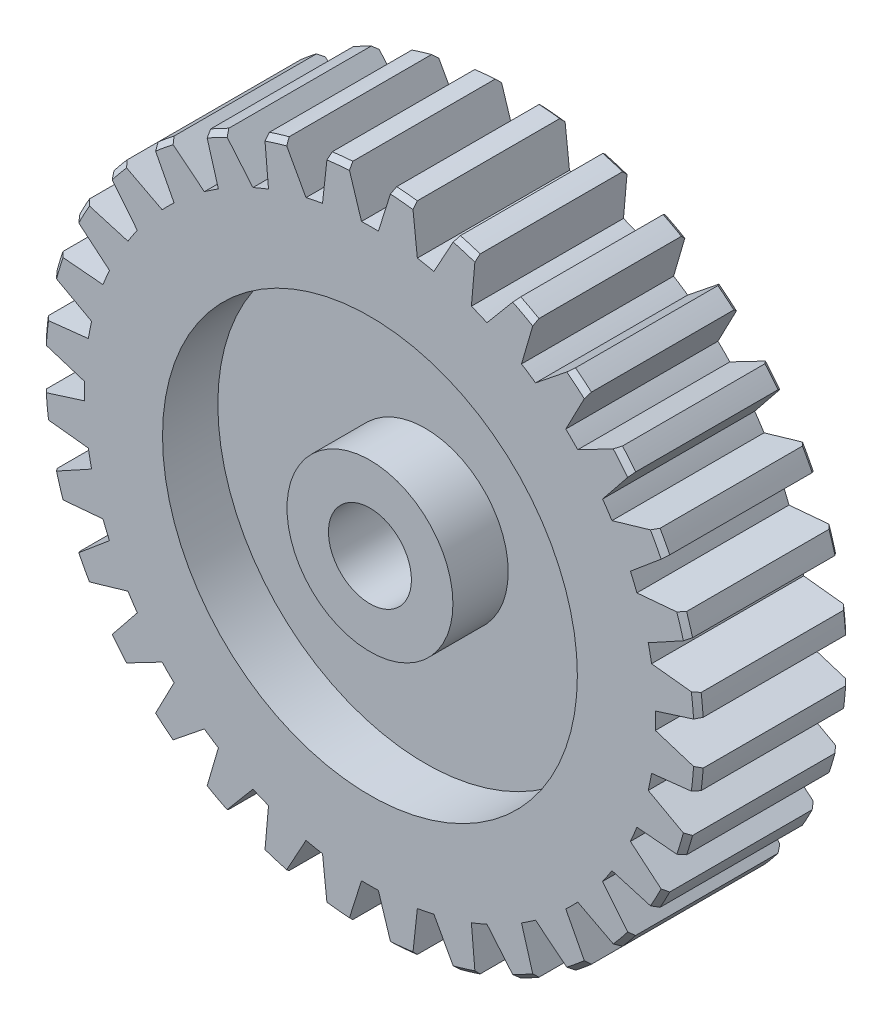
SolidWorks part; units mm, degrees
ref_plane "Plan1" through (0, 0, 0) normal (0, 0, 1) x (1, 0, 0)
ref_plane "Plan2" through (0, 0, 0) normal (0, 1, 0) x (1, 0, 0)
ref_plane "Plan3" through (0, 0, 0) normal (1, 0, 0) x (0, 0, -1)
sketch "Diamètre primitif" plane through (0, 0, 0) normal (0, 0, 1) x (1, 0, 0)
  line L0 (0, 0) -> (0.7, 0) construction
  circle A0 centre (0, 0) radius 11.2
  point P3 (0, 0)
  dimension "D1" = 22.4
  dimension "D2" = 0.7
sketch "Esquisse2" plane through (0, 0, 0) normal (0, 0, 1) x (1, 0, 0)
  circle A0 centre (0, 0) radius 11.9
  dimension "D1" = 23.8
extrude "Diamètre de tête" add sketch "Esquisse2" along normal mid plane 5.5
chamfer "Chanfreins" distance 0.175 angle 45
sketch "Esquisse3" plane through (0, 0, 0) normal (0, 0, 1) x (1, 0, 0)
  line L0 (0, 0) -> (0, 11.9) construction
  line L1 (-0.305, 10.3205) -> (-0.7946, 11.8734)
  line L2 (0.305, 10.3205) -> (0.7946, 11.8734)
  arc A0 (0.305, 10.3205) -> (-0.305, 10.3205) centre (0, 0) ccw
  circle A1 centre (0, 0) radius 11.9 construction
  arc A2 (0.7946, 11.8734) -> (-0.7946, 11.8734) centre (0, 0) ccw
  point P1 (-0.5498, 11.097)
  point P10 (0.5498, 11.097)
  dimension "D1" = 20.65
  dimension "D2" = 1.0996
  dimension "D3" = 325
extrude "Creux dent" cut sketch "Esquisse3" against normal through all and the other way through all
pattern_circular "Répétition" count 32 over 360
sketch "Esquisse4" plane through (0, 0, 2.75) normal (0, 0, 1) x (1, 0, 0)
  circle A0 centre (0, 0) radius 1.5
  dimension "D1" = 3
extrude "Passage axe" cut sketch "Esquisse4" against normal through all
sketch "Esquisse5" plane through (0, 0, 2.75) normal (0, 0, 1) x (1, 0, 0)
  circle A0 centre (0, 0) radius 3
  circle A1 centre (0, 0) radius 7.5
  dimension "D1" = 15
  dimension "D2" = 6
extrude "Gorge" cut sketch "Esquisse5" against normal blind 2
mirror "Symétrie gorge" about plane through (0, 0, 0) normal (0, 0, 1)
equation "\"D1@Esquisse2\" = \"D1@Diamètre primitif\" + 2 * \"D2@Diamètre primitif\""
equation "\"D1@Chanfreins\" = 0.25*\"D2@Diamètre primitif\""
equation "\"D1@Esquisse3\" = \"D1@Diamètre primitif\"-2.5*\"D2@Diamètre primitif\""
equation "\"D2@Esquisse3\"=3.14159*\"D2@Diamètre primitif\"/2"
equation "\"D1@Répétition\" = \"D1@Diamètre primitif\"/\"D2@Diamètre primitif\""
